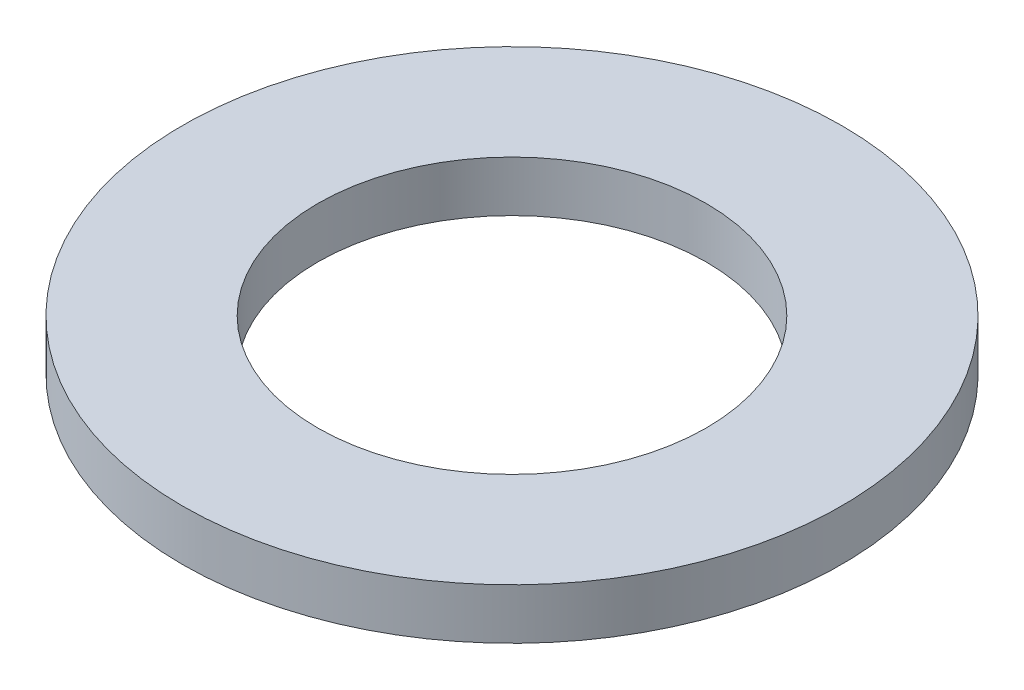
SolidWorks part; units mm, degrees
ref_plane "Front" through (0, 0, 0) normal (0, 0, 1) x (1, 0, 0)
ref_plane "Top" through (0, 0, 0) normal (0, 1, 0) x (1, 0, 0)
ref_plane "Right" through (0, 0, 0) normal (1, 0, 0) x (0, 0, -1)
sketch "Sketch1" plane through (0, 0, 0) normal (0, 1, 0) x (1, 0, 0)
  circle A0 centre (0, 0) radius 11.5
  circle A1 centre (0, 0) radius 19.5
extrude "Extrude1" add sketch "Sketch1" along normal blind 3
